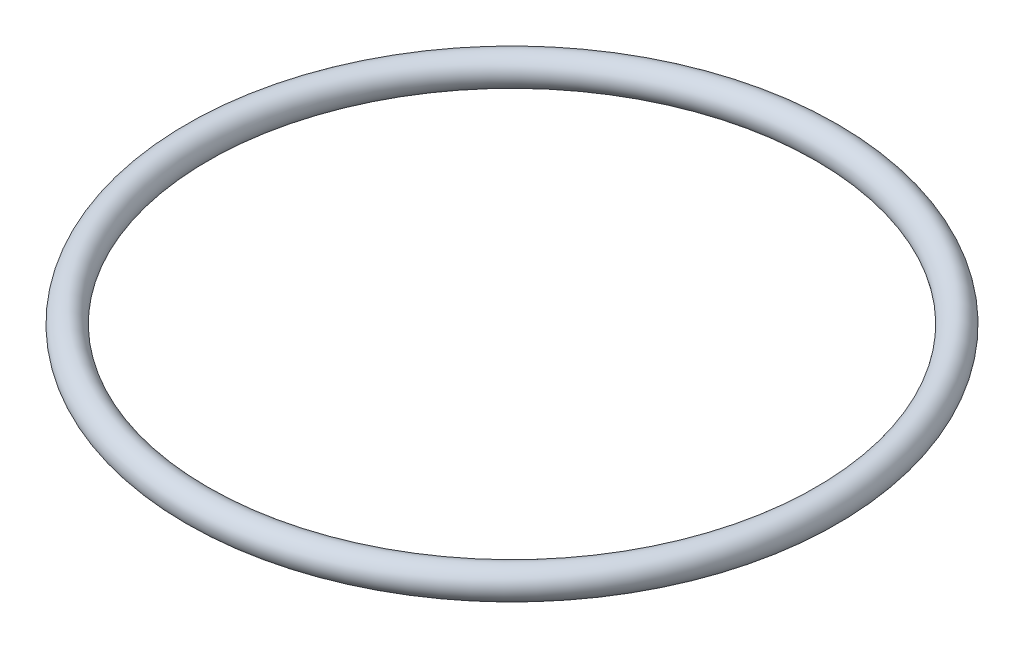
SolidWorks part; units mm, degrees
ref_plane "Plan1" through (0, 0, 0) normal (0, 0, 1) x (1, 0, 0)
ref_plane "Plan2" through (0, 0, 0) normal (0, 1, 0) x (1, 0, 0)
ref_plane "Plan3" through (0, 0, 0) normal (1, 0, 0) x (0, 0, -1)
sketch "Esquisse1" plane through (0, 0, 0) normal (0, 0, 1) x (1, 0, 0)
  line L1 (0, 0) -> (50, 0) construction
  line L2 (0, 1.25) -> (0, -1.25) construction
  circle A0 centre (26.25, 0) radius 1.25
  dimension "D2" = 26.25
  dimension "D1" = 2.5
  dimension "Diamètre du tore" = 2.5
  dimension "Diamètre intérieur" = 50
revolve "Base-Révolution" add sketch "Esquisse1" angle 360 about L2
equation " \"D1@Esquisse1\"=\"Diamètre du tore@Esquisse1\" "
equation "\"D2@Esquisse1\" = (\"Diamètre intérieur@Esquisse1\"/2)+(\"Diamètre du tore@Esquisse1\"/2)"
